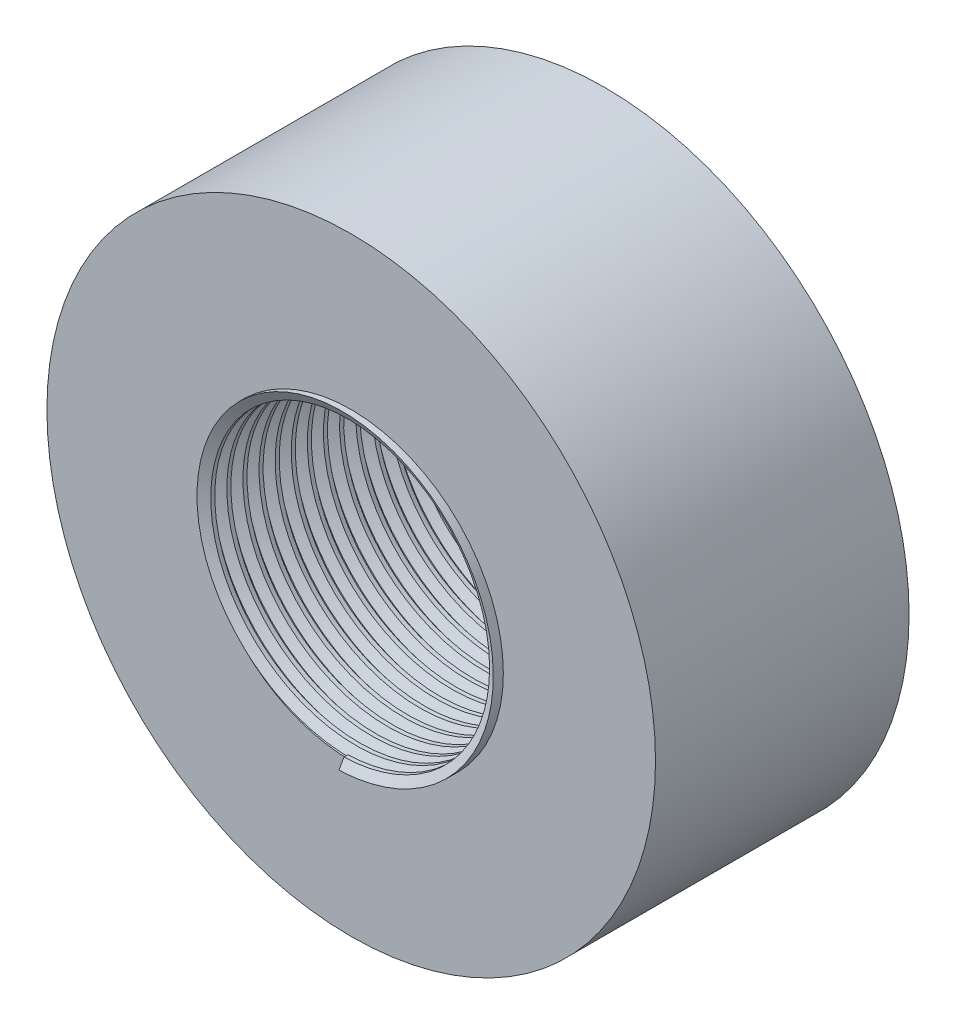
SolidWorks part; units mm, degrees
other "<TailWingThroughNut>-<Thread1>"
ref_plane "Front Plane" through (0, 0, 0) normal (0, 0, 1) x (1, 0, 0)
ref_plane "Top Plane" through (0, 0, 0) normal (0, 1, 0) x (1, 0, 0)
ref_plane "Right Plane" through (0, 0, 0) normal (1, 0, 0) x (0, 0, -1)
mirrored part "TailWingThroughNut_Mirrored"
